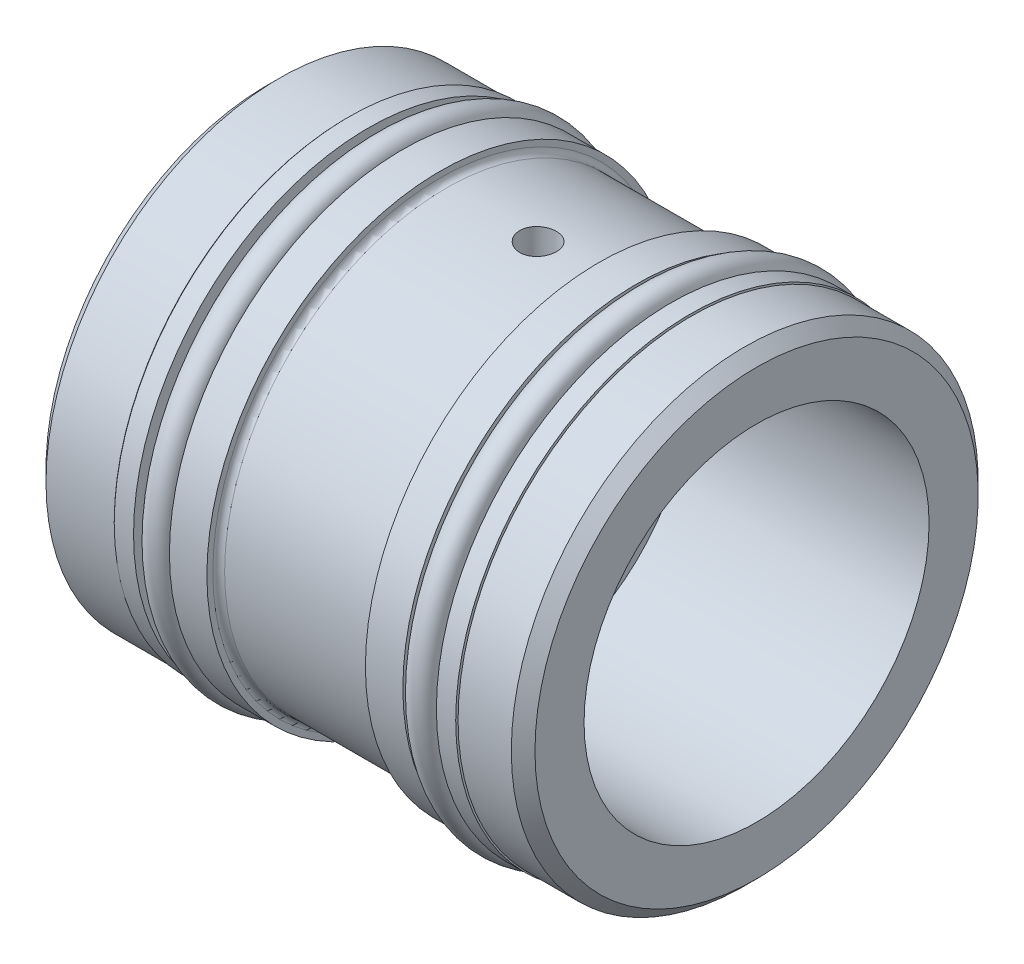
SolidWorks part; units mm, degrees
ref_plane "Front Plane" through (0, 0, 0) normal (0, 0, 1) x (1, 0, 0)
ref_plane "Top Plane" through (0, 0, 0) normal (0, 1, 0) x (1, 0, 0)
ref_plane "Right Plane" through (0, 0, 0) normal (1, 0, 0) x (0, 0, -1)
sketch "Sketch1" plane through (0, 0, 0) normal (0, 0, 1) x (1, 0, 0)
  line L0 (0, 0) -> (0, 45.5562) construction
  line L1 (0, 0) -> (32.8567, 0) construction
  line L2 (-15.748, 6.35) -> (-15.748, 15.0368)
  line L3 (-15.748, 15.0368) -> (-10.5918, 15.0368)
  line L4 (-10.5918, 15.0368) -> (-10.5918, 13.7668)
  line L5 (-10.5918, 13.7668) -> (-7.0358, 13.7668)
  line L6 (-7.0358, 13.7668) -> (-7.0358, 15.0368)
  line L7 (-7.0358, 15.0368) -> (-4.6228, 15.0368)
  line L8 (-4.6228, 15.0368) -> (-4.6228, 14.2748)
  line L9 (-4.6228, 14.2748) -> (5.588, 14.2748)
  line L10 (-15.748, 6.35) -> (0.3556, 6.35)
  line L11 (0.3556, 6.35) -> (0.3556, 11.1125)
  line L12 (0.3556, 11.1125) -> (15.748, 11.1125)
  line L13 (5.588, 15.0368) -> (5.588, 14.2748)
  line L14 (8.001, 15.0368) -> (5.588, 15.0368)
  line L15 (8.001, 13.7668) -> (8.001, 15.0368)
  line L16 (11.557, 13.7668) -> (8.001, 13.7668)
  line L17 (11.557, 15.0368) -> (11.557, 13.7668)
  line L18 (15.748, 15.0368) -> (11.557, 15.0368)
  line L19 (15.748, 15.0368) -> (15.748, 11.1125)
  dimension "D2" = 3.556
  dimension "D3" = 10.2108
  dimension "D4" = 30.0736
  dimension "D5" = 31.496
  dimension "D6" = 22.225
  dimension "D7" = 15.3924
  dimension "D8" = 28.5496
  dimension "D9" = 27.5336
  dimension "D10" = 12.7
  dimension "D11" = 26.3398
  dimension "D12" = 2.413
  dimension "D13" = 2.413
revolve "Revolve1" add sketch "Sketch1" angle 360 about L1
fillet "Fillet1" radius 0.381 2 edges at (5.588, 0, 14.2748) (-4.6228, 0, 14.2748)
chamfer "Chamfer1" distance 0.762 angle 45 2 edges at (15.748, 0, 15.0368) (-15.748, 0, 15.0368)
sketch "Sketch6" plane through (0, 0, 0) normal (0, 0, 1) x (1, 0, 0)
  line L0 (0, 0) -> (49.5791, 0) construction
  line L1 (-15.748, 14.2748) -> (-15.748, -14.2748) construction
  line L2 (-7.0358, 13.7668) -> (-10.5918, 13.7668) construction
  line L3 (-10.5156, 13.7668) -> (-9.271, 13.7668)
  line L4 (-10.5156, 13.7668) -> (-10.5156, 15.113)
  line L5 (-10.5156, 15.113) -> (-9.271, 15.113)
  line L6 (-9.271, 13.7668) -> (-9.271, 15.113)
  line L7 (0.4826, 41.4439) -> (0.4826, -9.3524) construction
  line L8 (-10.5918, -15.0368) -> (-10.5918, 15.0368) construction
  line L9 (11.557, 13.7668) -> (11.557, -13.7668) construction
  line L10 (-7.0358, 15.0368) -> (-7.0358, -15.0368) construction
  line L11 (10.2362, 13.7668) -> (10.2362, 15.113)
  line L12 (11.4808, 15.113) -> (10.2362, 15.113)
  line L13 (11.4808, 13.7668) -> (11.4808, 15.113)
  line L14 (11.4808, 13.7668) -> (10.2362, 13.7668)
  circle A0 centre (-8.001, 14.5796) radius 0.889
  circle A1 centre (8.9662, 14.5796) radius 0.889
  dimension "D4" = 1.778
  dimension "D5" = 29.1592
  dimension "D6" = 0.9652
  dimension "D1" = 1.2446
  dimension "D2" = 5.2324
  dimension "D3" = 30.226
revolve "Revolve3" add sketch "Sketch6" angle 360 about L0
sketch "Sketch7" plane through (0, 0, 0) normal (0, 1, 0) x (0, 0, -1)
  line L1 (-14.2748, -15.748) -> (14.2748, -15.748) construction
  circle A0 centre (0, -1.6764) radius 1.1811
  dimension "D1" = 2.3622
  dimension "D2" = 14.0716
extrude "Cut-Extrude1" cut sketch "Sketch7" against normal through all and the other way through all
